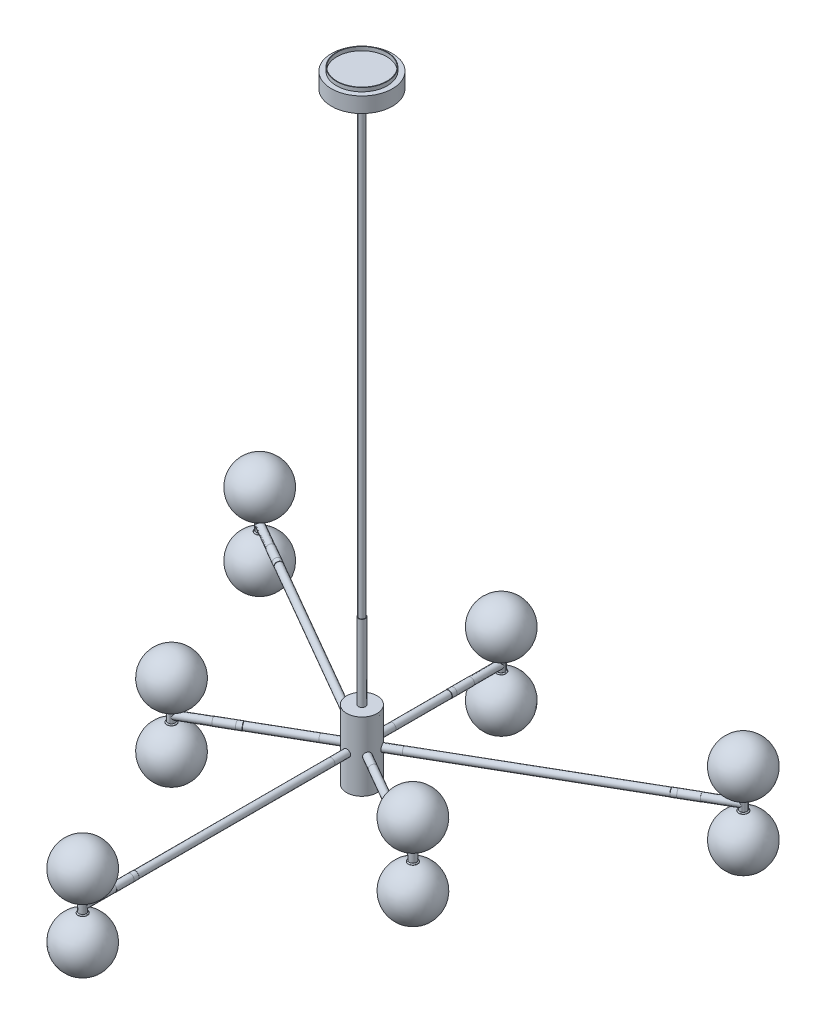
SolidWorks part; units mm, degrees
ref_plane "Alzado" through (0, 0, 0) normal (0, 0, 1) x (1, 0, 0)
ref_plane "Planta" through (0, 0, 0) normal (0, 1, 0) x (1, 0, 0)
ref_plane "Vista lateral" through (0, 0, 0) normal (1, 0, 0) x (0, 0, -1)
imported_body "C1280-6.IGS<1>"
delete or keep bodies "Sólido-Eliminar/Conservar 1" type delete bodies bodies 195
ref_plane "Plano1" through (0, 1183.64, 0) normal (0, 1, 0) x (1, 0, 0)
sketch "Croquis2" plane through (0, 1183.64, 0) normal (0, 1, 0) x (1, 0, 0)
  circle A0 centre (0, 0) radius 59.944
  dimension "D1" = 119.888
extrude "Saliente-Extruir1" add sketch "Croquis2" along normal blind 29.972 separate body
